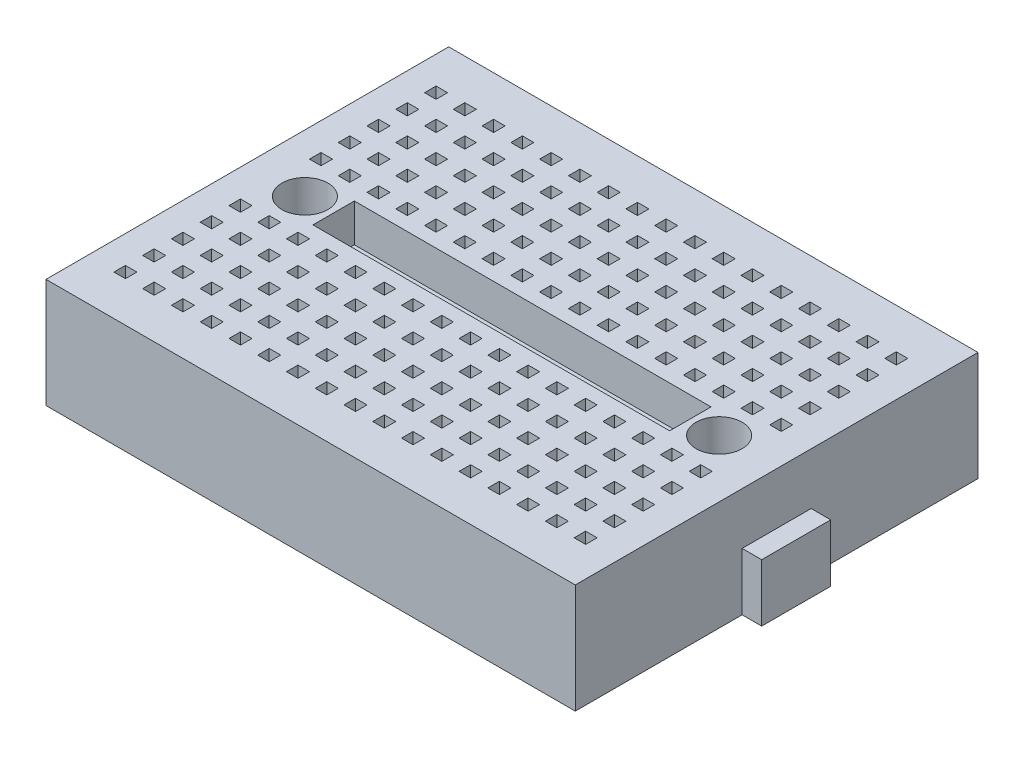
SolidWorks part; units mm, degrees
ref_plane "Alzado" through (0, 0, 0) normal (0, 0, 1) x (1, 0, 0)
ref_plane "Planta" through (0, 0, 0) normal (0, 1, 0) x (1, 0, 0)
ref_plane "Vista lateral" through (0, 0, 0) normal (1, 0, 0) x (0, 0, -1)
sketch "Croquis1" plane through (0, 0, 0) normal (0, 1, 0) x (1, 0, 0)
  line L1 (0, 0) -> (46, 0)
  line L2 (0, 0) -> (0, 35)
  line L3 (0, 35) -> (46, 35)
  line L4 (46, 0) -> (46, 35)
  dimension "D1" = 35
  dimension "D2" = 46
extrude "Saliente-Extruir1" add sketch "Croquis1" along normal blind 9.5
sketch "Croquis2" plane through (46, 0, 0) normal (1, 0, 0) x (0, 0, -1)
  line L0 (0, 0) -> (35, 0) construction
  line L1 (20.5, 0) -> (14.5, 0)
  line L2 (20.5, 0) -> (20.5, 5)
  line L3 (20.5, 5) -> (14.5, 5)
  line L4 (14.5, 0) -> (14.5, 5)
  line L5 (0, 9.5) -> (0, 0) construction
  line L6 (35, 9.5) -> (35, 0) construction
  dimension "D1" = 14.5
  dimension "D2" = 14.5
  dimension "D3" = 5
extrude "Saliente-Extruir2" add sketch "Croquis2" along normal blind 1.7
sketch "Croquis3" plane through (0, 9.5, 0) normal (0, 1, 0) x (1, 0, 0)
  line L0 (46, 0) -> (46, 35) construction
  line L1 (7.5, 19.3) -> (38.5, 19.3)
  line L2 (7.5, 19.3) -> (7.5, 15.7)
  line L3 (7.5, 15.7) -> (38.5, 15.7)
  line L4 (38.5, 19.3) -> (38.5, 15.7)
  line L5 (0, 35) -> (0, 0) construction
  point P8 (7.5, 17.5)
  point P9 (0, 17.5)
  dimension "D1" = 3.6
  dimension "D2" = 7.5
  dimension "D3" = 7.5
extrude "Cortar-Extruir1" cut sketch "Croquis3" against normal blind 3.3
sketch "Croquis4" plane through (0, 9.5, 0) normal (0, 1, 0) x (1, 0, 0)
  line L0 (7.5, 19.3) -> (7.5, 15.7) construction
  line L1 (0, 35) -> (0, 0) construction
  line L2 (46, 0) -> (46, 35) construction
  circle A0 centre (41, 17.5) radius 2
  circle A1 centre (5, 17.5) radius 2
  point P6 (7.5, 17.5)
  dimension "D1" = 4
  dimension "D2" = 5
  dimension "D3" = 5
extrude "Cortar-Extruir2" cut sketch "Croquis4" against normal blind 3.5
sketch "Croquis5" plane through (0, 0, -35) normal (0, 0, -1) x (-1, 0, 0)
  line L0 (-46, 0) -> (0, 0) construction
  line L1 (-25.25, 0) -> (-20.75, 0)
  line L2 (-25.25, 0) -> (-25.25, 5)
  line L3 (-25.25, 5) -> (-20.75, 5)
  line L4 (-20.75, 0) -> (-20.75, 5)
  line L5 (-46, 9.5) -> (0, 9.5) construction
  point P6 (-23, 5)
  point P9 (-23, 9.5)
  dimension "D1" = 4.5
  dimension "D2" = 5
extrude "Saliente-Extruir3" add sketch "Croquis5" along normal blind 1.5
sketch "Croquis6" plane through (0, 9.5, 0) normal (0, 1, 0) x (1, 0, 0)
  line L0 (0, 35) -> (0, 0) construction
  line L1 (2.4, 14.5) -> (3.4, 14.5)
  line L2 (2.4, 14.5) -> (2.4, 13.5)
  line L3 (2.4, 13.5) -> (3.4, 13.5)
  line L4 (3.4, 14.5) -> (3.4, 13.5)
  line L6 (7.5, 15.7) -> (38.5, 15.7) construction
  line L7 (5.9, 14.5) -> (5.9, 13.5)
  line L8 (4.9, 14.5) -> (5.9, 14.5)
  line L9 (4.9, 14.5) -> (4.9, 13.5)
  line L10 (4.9, 13.5) -> (5.9, 13.5)
  line L11 (8.4, 14.5) -> (8.4, 13.5)
  line L12 (7.4, 14.5) -> (8.4, 14.5)
  line L13 (7.4, 14.5) -> (7.4, 13.5)
  line L14 (7.4, 13.5) -> (8.4, 13.5)
  line L15 (10.9, 14.5) -> (10.9, 13.5)
  line L16 (9.9, 14.5) -> (10.9, 14.5)
  line L17 (9.9, 14.5) -> (9.9, 13.5)
  line L18 (9.9, 13.5) -> (10.9, 13.5)
  line L19 (13.4, 14.5) -> (13.4, 13.5)
  line L20 (12.4, 14.5) -> (13.4, 14.5)
  line L21 (12.4, 14.5) -> (12.4, 13.5)
  line L22 (12.4, 13.5) -> (13.4, 13.5)
  line L23 (15.9, 14.5) -> (15.9, 13.5)
  line L24 (14.9, 14.5) -> (15.9, 14.5)
  line L25 (14.9, 14.5) -> (14.9, 13.5)
  line L26 (14.9, 13.5) -> (15.9, 13.5)
  line L27 (18.4, 14.5) -> (18.4, 13.5)
  line L28 (17.4, 14.5) -> (18.4, 14.5)
  line L29 (17.4, 14.5) -> (17.4, 13.5)
  line L30 (17.4, 13.5) -> (18.4, 13.5)
  line L31 (20.9, 14.5) -> (20.9, 13.5)
  line L32 (19.9, 14.5) -> (20.9, 14.5)
  line L33 (19.9, 14.5) -> (19.9, 13.5)
  line L34 (19.9, 13.5) -> (20.9, 13.5)
  line L35 (23.4, 14.5) -> (23.4, 13.5)
  line L36 (22.4, 14.5) -> (23.4, 14.5)
  line L37 (22.4, 14.5) -> (22.4, 13.5)
  line L38 (22.4, 13.5) -> (23.4, 13.5)
  line L39 (25.9, 14.5) -> (25.9, 13.5)
  line L40 (24.9, 14.5) -> (25.9, 14.5)
  line L41 (24.9, 14.5) -> (24.9, 13.5)
  line L42 (24.9, 13.5) -> (25.9, 13.5)
  line L43 (28.4, 14.5) -> (28.4, 13.5)
  line L44 (27.4, 14.5) -> (28.4, 14.5)
  line L45 (27.4, 14.5) -> (27.4, 13.5)
  line L46 (27.4, 13.5) -> (28.4, 13.5)
  line L47 (30.9, 14.5) -> (30.9, 13.5)
  line L48 (29.9, 14.5) -> (30.9, 14.5)
  line L49 (29.9, 14.5) -> (29.9, 13.5)
  line L50 (29.9, 13.5) -> (30.9, 13.5)
  line L51 (33.4, 14.5) -> (33.4, 13.5)
  line L52 (32.4, 14.5) -> (33.4, 14.5)
  line L53 (32.4, 14.5) -> (32.4, 13.5)
  line L54 (32.4, 13.5) -> (33.4, 13.5)
  line L55 (35.9, 14.5) -> (35.9, 13.5)
  line L56 (34.9, 14.5) -> (35.9, 14.5)
  line L57 (34.9, 14.5) -> (34.9, 13.5)
  line L58 (34.9, 13.5) -> (35.9, 13.5)
  line L59 (38.4, 14.5) -> (38.4, 13.5)
  line L60 (37.4, 14.5) -> (38.4, 14.5)
  line L61 (37.4, 14.5) -> (37.4, 13.5)
  line L62 (37.4, 13.5) -> (38.4, 13.5)
  line L63 (40.9, 14.5) -> (40.9, 13.5)
  line L64 (39.9, 14.5) -> (40.9, 14.5)
  line L65 (39.9, 14.5) -> (39.9, 13.5)
  line L66 (39.9, 13.5) -> (40.9, 13.5)
  line L67 (43.4, 14.5) -> (43.4, 13.5)
  line L68 (42.4, 14.5) -> (43.4, 14.5)
  line L69 (42.4, 14.5) -> (42.4, 13.5)
  line L70 (42.4, 13.5) -> (43.4, 13.5)
  line L71 (5.9, 12) -> (5.9, 11)
  line L72 (4.9, 12) -> (5.9, 12)
  line L73 (4.9, 12) -> (4.9, 11)
  line L74 (4.9, 11) -> (5.9, 11)
  line L75 (8.4, 12) -> (8.4, 11)
  line L76 (7.4, 12) -> (8.4, 12)
  line L77 (7.4, 12) -> (7.4, 11)
  line L78 (7.4, 11) -> (8.4, 11)
  line L79 (10.9, 12) -> (10.9, 11)
  line L80 (9.9, 12) -> (10.9, 12)
  line L81 (9.9, 12) -> (9.9, 11)
  line L82 (9.9, 11) -> (10.9, 11)
  line L83 (13.4, 12) -> (13.4, 11)
  line L84 (12.4, 12) -> (13.4, 12)
  line L85 (12.4, 12) -> (12.4, 11)
  line L86 (12.4, 11) -> (13.4, 11)
  line L87 (15.9, 12) -> (15.9, 11)
  line L88 (14.9, 12) -> (15.9, 12)
  line L89 (14.9, 12) -> (14.9, 11)
  line L90 (14.9, 11) -> (15.9, 11)
  line L91 (18.4, 12) -> (18.4, 11)
  line L92 (17.4, 12) -> (18.4, 12)
  line L93 (17.4, 12) -> (17.4, 11)
  line L94 (17.4, 11) -> (18.4, 11)
  line L95 (20.9, 12) -> (20.9, 11)
  line L96 (19.9, 12) -> (20.9, 12)
  line L97 (19.9, 12) -> (19.9, 11)
  line L98 (19.9, 11) -> (20.9, 11)
  line L99 (23.4, 12) -> (23.4, 11)
  line L100 (22.4, 12) -> (23.4, 12)
  line L101 (22.4, 12) -> (22.4, 11)
  line L102 (22.4, 11) -> (23.4, 11)
  line L103 (25.9, 12) -> (25.9, 11)
  line L104 (24.9, 12) -> (25.9, 12)
  line L105 (24.9, 12) -> (24.9, 11)
  line L106 (24.9, 11) -> (25.9, 11)
  line L107 (28.4, 12) -> (28.4, 11)
  line L108 (27.4, 12) -> (28.4, 12)
  line L109 (27.4, 12) -> (27.4, 11)
  line L110 (27.4, 11) -> (28.4, 11)
  line L111 (30.9, 12) -> (30.9, 11)
  line L112 (29.9, 12) -> (30.9, 12)
  line L113 (29.9, 12) -> (29.9, 11)
  line L114 (29.9, 11) -> (30.9, 11)
  line L115 (33.4, 12) -> (33.4, 11)
  line L116 (32.4, 12) -> (33.4, 12)
  line L117 (32.4, 12) -> (32.4, 11)
  line L118 (32.4, 11) -> (33.4, 11)
  line L119 (35.9, 12) -> (35.9, 11)
  line L120 (34.9, 12) -> (35.9, 12)
  line L121 (34.9, 12) -> (34.9, 11)
  line L122 (34.9, 11) -> (35.9, 11)
  line L123 (38.4, 12) -> (38.4, 11)
  line L124 (37.4, 12) -> (38.4, 12)
  line L125 (37.4, 12) -> (37.4, 11)
  line L126 (37.4, 11) -> (38.4, 11)
  line L127 (40.9, 12) -> (40.9, 11)
  line L128 (39.9, 12) -> (40.9, 12)
  line L129 (39.9, 12) -> (39.9, 11)
  line L130 (39.9, 11) -> (40.9, 11)
  line L131 (43.4, 12) -> (43.4, 11)
  line L132 (42.4, 12) -> (43.4, 12)
  line L133 (42.4, 12) -> (42.4, 11)
  line L134 (42.4, 11) -> (43.4, 11)
  line L135 (5.9, 9.5) -> (5.9, 8.5)
  line L136 (4.9, 9.5) -> (5.9, 9.5)
  line L137 (4.9, 9.5) -> (4.9, 8.5)
  line L138 (4.9, 8.5) -> (5.9, 8.5)
  line L139 (8.4, 9.5) -> (8.4, 8.5)
  line L140 (7.4, 9.5) -> (8.4, 9.5)
  line L141 (7.4, 9.5) -> (7.4, 8.5)
  line L142 (7.4, 8.5) -> (8.4, 8.5)
  line L143 (10.9, 9.5) -> (10.9, 8.5)
  line L144 (9.9, 9.5) -> (10.9, 9.5)
  line L145 (9.9, 9.5) -> (9.9, 8.5)
  line L146 (9.9, 8.5) -> (10.9, 8.5)
  line L147 (13.4, 9.5) -> (13.4, 8.5)
  line L148 (12.4, 9.5) -> (13.4, 9.5)
  line L149 (12.4, 9.5) -> (12.4, 8.5)
  line L150 (12.4, 8.5) -> (13.4, 8.5)
  line L151 (15.9, 9.5) -> (15.9, 8.5)
  line L152 (14.9, 9.5) -> (15.9, 9.5)
  line L153 (14.9, 9.5) -> (14.9, 8.5)
  line L154 (14.9, 8.5) -> (15.9, 8.5)
  line L155 (18.4, 9.5) -> (18.4, 8.5)
  line L156 (17.4, 9.5) -> (18.4, 9.5)
  line L157 (17.4, 9.5) -> (17.4, 8.5)
  line L158 (17.4, 8.5) -> (18.4, 8.5)
  line L159 (20.9, 9.5) -> (20.9, 8.5)
  line L160 (19.9, 9.5) -> (20.9, 9.5)
  line L161 (19.9, 9.5) -> (19.9, 8.5)
  line L162 (19.9, 8.5) -> (20.9, 8.5)
  line L163 (23.4, 9.5) -> (23.4, 8.5)
  line L164 (22.4, 9.5) -> (23.4, 9.5)
  line L165 (22.4, 9.5) -> (22.4, 8.5)
  line L166 (22.4, 8.5) -> (23.4, 8.5)
  line L167 (25.9, 9.5) -> (25.9, 8.5)
  line L168 (24.9, 9.5) -> (25.9, 9.5)
  line L169 (24.9, 9.5) -> (24.9, 8.5)
  line L170 (24.9, 8.5) -> (25.9, 8.5)
  line L171 (28.4, 9.5) -> (28.4, 8.5)
  line L172 (27.4, 9.5) -> (28.4, 9.5)
  line L173 (27.4, 9.5) -> (27.4, 8.5)
  line L174 (27.4, 8.5) -> (28.4, 8.5)
  line L175 (30.9, 9.5) -> (30.9, 8.5)
  line L176 (29.9, 9.5) -> (30.9, 9.5)
  line L177 (29.9, 9.5) -> (29.9, 8.5)
  line L178 (29.9, 8.5) -> (30.9, 8.5)
  line L179 (33.4, 9.5) -> (33.4, 8.5)
  line L180 (32.4, 9.5) -> (33.4, 9.5)
  line L181 (32.4, 9.5) -> (32.4, 8.5)
  line L182 (32.4, 8.5) -> (33.4, 8.5)
  line L183 (35.9, 9.5) -> (35.9, 8.5)
  line L184 (34.9, 9.5) -> (35.9, 9.5)
  line L185 (34.9, 9.5) -> (34.9, 8.5)
  line L186 (34.9, 8.5) -> (35.9, 8.5)
  line L187 (38.4, 9.5) -> (38.4, 8.5)
  line L188 (37.4, 9.5) -> (38.4, 9.5)
  line L189 (37.4, 9.5) -> (37.4, 8.5)
  line L190 (37.4, 8.5) -> (38.4, 8.5)
  line L191 (40.9, 9.5) -> (40.9, 8.5)
  line L192 (39.9, 9.5) -> (40.9, 9.5)
  line L193 (39.9, 9.5) -> (39.9, 8.5)
  line L194 (39.9, 8.5) -> (40.9, 8.5)
  line L195 (43.4, 9.5) -> (43.4, 8.5)
  line L196 (42.4, 9.5) -> (43.4, 9.5)
  line L197 (42.4, 9.5) -> (42.4, 8.5)
  line L198 (42.4, 8.5) -> (43.4, 8.5)
  line L199 (5.9, 7) -> (5.9, 6)
  line L200 (4.9, 7) -> (5.9, 7)
  line L201 (4.9, 7) -> (4.9, 6)
  line L202 (4.9, 6) -> (5.9, 6)
  line L203 (8.4, 7) -> (8.4, 6)
  line L204 (7.4, 7) -> (8.4, 7)
  line L205 (7.4, 7) -> (7.4, 6)
  line L206 (7.4, 6) -> (8.4, 6)
  line L207 (10.9, 7) -> (10.9, 6)
  line L208 (9.9, 7) -> (10.9, 7)
  line L209 (9.9, 7) -> (9.9, 6)
  line L210 (9.9, 6) -> (10.9, 6)
  line L211 (13.4, 7) -> (13.4, 6)
  line L212 (12.4, 7) -> (13.4, 7)
  line L213 (12.4, 7) -> (12.4, 6)
  line L214 (12.4, 6) -> (13.4, 6)
  line L215 (15.9, 7) -> (15.9, 6)
  line L216 (14.9, 7) -> (15.9, 7)
  line L217 (14.9, 7) -> (14.9, 6)
  line L218 (14.9, 6) -> (15.9, 6)
  line L219 (18.4, 7) -> (18.4, 6)
  line L220 (17.4, 7) -> (18.4, 7)
  line L221 (17.4, 7) -> (17.4, 6)
  line L222 (17.4, 6) -> (18.4, 6)
  line L223 (20.9, 7) -> (20.9, 6)
  line L224 (19.9, 7) -> (20.9, 7)
  line L225 (19.9, 7) -> (19.9, 6)
  line L226 (19.9, 6) -> (20.9, 6)
  line L227 (23.4, 7) -> (23.4, 6)
  line L228 (22.4, 7) -> (23.4, 7)
  line L229 (22.4, 7) -> (22.4, 6)
  line L230 (22.4, 6) -> (23.4, 6)
  line L231 (25.9, 7) -> (25.9, 6)
  line L232 (24.9, 7) -> (25.9, 7)
  line L233 (24.9, 7) -> (24.9, 6)
  line L234 (24.9, 6) -> (25.9, 6)
  line L235 (28.4, 7) -> (28.4, 6)
  line L236 (27.4, 7) -> (28.4, 7)
  line L237 (27.4, 7) -> (27.4, 6)
  line L238 (27.4, 6) -> (28.4, 6)
  line L239 (30.9, 7) -> (30.9, 6)
  line L240 (29.9, 7) -> (30.9, 7)
  line L241 (29.9, 7) -> (29.9, 6)
  line L242 (29.9, 6) -> (30.9, 6)
  line L243 (33.4, 7) -> (33.4, 6)
  line L244 (32.4, 7) -> (33.4, 7)
  line L245 (32.4, 7) -> (32.4, 6)
  line L246 (32.4, 6) -> (33.4, 6)
  line L247 (35.9, 7) -> (35.9, 6)
  line L248 (34.9, 7) -> (35.9, 7)
  line L249 (34.9, 7) -> (34.9, 6)
  line L250 (34.9, 6) -> (35.9, 6)
  line L251 (38.4, 7) -> (38.4, 6)
  line L252 (37.4, 7) -> (38.4, 7)
  line L253 (37.4, 7) -> (37.4, 6)
  line L254 (37.4, 6) -> (38.4, 6)
  line L255 (40.9, 7) -> (40.9, 6)
  line L256 (39.9, 7) -> (40.9, 7)
  line L257 (39.9, 7) -> (39.9, 6)
  line L258 (39.9, 6) -> (40.9, 6)
  line L259 (43.4, 7) -> (43.4, 6)
  line L260 (42.4, 7) -> (43.4, 7)
  line L261 (42.4, 7) -> (42.4, 6)
  line L262 (42.4, 6) -> (43.4, 6)
  line L263 (5.9, 4.5) -> (5.9, 3.5)
  line L264 (4.9, 4.5) -> (5.9, 4.5)
  line L265 (4.9, 4.5) -> (4.9, 3.5)
  line L266 (4.9, 3.5) -> (5.9, 3.5)
  line L267 (8.4, 4.5) -> (8.4, 3.5)
  line L268 (7.4, 4.5) -> (8.4, 4.5)
  line L269 (7.4, 4.5) -> (7.4, 3.5)
  line L270 (7.4, 3.5) -> (8.4, 3.5)
  line L271 (10.9, 4.5) -> (10.9, 3.5)
  line L272 (9.9, 4.5) -> (10.9, 4.5)
  line L273 (9.9, 4.5) -> (9.9, 3.5)
  line L274 (9.9, 3.5) -> (10.9, 3.5)
  line L275 (13.4, 4.5) -> (13.4, 3.5)
  line L276 (12.4, 4.5) -> (13.4, 4.5)
  line L277 (12.4, 4.5) -> (12.4, 3.5)
  line L278 (12.4, 3.5) -> (13.4, 3.5)
  line L279 (15.9, 4.5) -> (15.9, 3.5)
  line L280 (14.9, 4.5) -> (15.9, 4.5)
  line L281 (14.9, 4.5) -> (14.9, 3.5)
  line L282 (14.9, 3.5) -> (15.9, 3.5)
  line L283 (18.4, 4.5) -> (18.4, 3.5)
  line L284 (17.4, 4.5) -> (18.4, 4.5)
  line L285 (17.4, 4.5) -> (17.4, 3.5)
  line L286 (17.4, 3.5) -> (18.4, 3.5)
  line L287 (20.9, 4.5) -> (20.9, 3.5)
  line L288 (19.9, 4.5) -> (20.9, 4.5)
  line L289 (19.9, 4.5) -> (19.9, 3.5)
  line L290 (19.9, 3.5) -> (20.9, 3.5)
  line L291 (23.4, 4.5) -> (23.4, 3.5)
  line L292 (22.4, 4.5) -> (23.4, 4.5)
  line L293 (22.4, 4.5) -> (22.4, 3.5)
  line L294 (22.4, 3.5) -> (23.4, 3.5)
  line L295 (25.9, 4.5) -> (25.9, 3.5)
  line L296 (24.9, 4.5) -> (25.9, 4.5)
  line L297 (24.9, 4.5) -> (24.9, 3.5)
  line L298 (24.9, 3.5) -> (25.9, 3.5)
  line L299 (28.4, 4.5) -> (28.4, 3.5)
  line L300 (27.4, 4.5) -> (28.4, 4.5)
  line L301 (27.4, 4.5) -> (27.4, 3.5)
  line L302 (27.4, 3.5) -> (28.4, 3.5)
  line L303 (30.9, 4.5) -> (30.9, 3.5)
  line L304 (29.9, 4.5) -> (30.9, 4.5)
  line L305 (29.9, 4.5) -> (29.9, 3.5)
  line L306 (29.9, 3.5) -> (30.9, 3.5)
  line L307 (33.4, 4.5) -> (33.4, 3.5)
  line L308 (32.4, 4.5) -> (33.4, 4.5)
  line L309 (32.4, 4.5) -> (32.4, 3.5)
  line L310 (32.4, 3.5) -> (33.4, 3.5)
  line L311 (35.9, 4.5) -> (35.9, 3.5)
  line L312 (34.9, 4.5) -> (35.9, 4.5)
  line L313 (34.9, 4.5) -> (34.9, 3.5)
  line L314 (34.9, 3.5) -> (35.9, 3.5)
  line L315 (38.4, 4.5) -> (38.4, 3.5)
  line L316 (37.4, 4.5) -> (38.4, 4.5)
  line L317 (37.4, 4.5) -> (37.4, 3.5)
  line L318 (37.4, 3.5) -> (38.4, 3.5)
  line L319 (40.9, 4.5) -> (40.9, 3.5)
  line L320 (39.9, 4.5) -> (40.9, 4.5)
  line L321 (39.9, 4.5) -> (39.9, 3.5)
  line L322 (39.9, 3.5) -> (40.9, 3.5)
  line L323 (43.4, 4.5) -> (43.4, 3.5)
  line L324 (42.4, 4.5) -> (43.4, 4.5)
  line L325 (42.4, 4.5) -> (42.4, 3.5)
  line L326 (42.4, 3.5) -> (43.4, 3.5)
  line L327 (3.4, 12) -> (3.4, 11)
  line L328 (2.4, 12) -> (3.4, 12)
  line L329 (2.4, 12) -> (2.4, 11)
  line L330 (2.4, 11) -> (3.4, 11)
  line L331 (3.4, 9.5) -> (3.4, 8.5)
  line L332 (2.4, 9.5) -> (3.4, 9.5)
  line L333 (2.4, 9.5) -> (2.4, 8.5)
  line L334 (2.4, 8.5) -> (3.4, 8.5)
  line L335 (3.4, 7) -> (3.4, 6)
  line L336 (2.4, 7) -> (3.4, 7)
  line L337 (2.4, 7) -> (2.4, 6)
  line L338 (2.4, 6) -> (3.4, 6)
  line L339 (3.4, 4.5) -> (3.4, 3.5)
  line L340 (2.4, 4.5) -> (3.4, 4.5)
  line L341 (2.4, 4.5) -> (2.4, 3.5)
  line L342 (2.4, 3.5) -> (3.4, 3.5)
  line L343 (0, 0) -> (46, 0) construction
  line L344 (46, 0) -> (46, 35) construction
  line L345 (7.5, 17.5) -> (38.5, 17.5) construction
  line L346 (7.5, 19.3) -> (7.5, 15.7) construction
  line L347 (38.5, 15.7) -> (38.5, 19.3) construction
  line L348 (2.4, 31.5) -> (3.4, 31.5)
  line L349 (2.4, 30.5) -> (2.4, 31.5)
  line L350 (2.4, 30.5) -> (3.4, 30.5)
  line L351 (3.4, 30.5) -> (3.4, 31.5)
  line L352 (2.4, 29) -> (3.4, 29)
  line L353 (2.4, 28) -> (2.4, 29)
  line L354 (2.4, 28) -> (3.4, 28)
  line L355 (3.4, 28) -> (3.4, 29)
  line L356 (2.4, 26.5) -> (3.4, 26.5)
  line L357 (2.4, 25.5) -> (2.4, 26.5)
  line L358 (2.4, 25.5) -> (3.4, 25.5)
  line L359 (3.4, 25.5) -> (3.4, 26.5)
  line L360 (2.4, 24) -> (3.4, 24)
  line L361 (2.4, 23) -> (2.4, 24)
  line L362 (2.4, 23) -> (3.4, 23)
  line L363 (3.4, 23) -> (3.4, 24)
  line L364 (42.4, 31.5) -> (43.4, 31.5)
  line L365 (42.4, 30.5) -> (42.4, 31.5)
  line L366 (42.4, 30.5) -> (43.4, 30.5)
  line L367 (43.4, 30.5) -> (43.4, 31.5)
  line L368 (39.9, 31.5) -> (40.9, 31.5)
  line L369 (39.9, 30.5) -> (39.9, 31.5)
  line L370 (39.9, 30.5) -> (40.9, 30.5)
  line L371 (40.9, 30.5) -> (40.9, 31.5)
  line L372 (37.4, 31.5) -> (38.4, 31.5)
  line L373 (37.4, 30.5) -> (37.4, 31.5)
  line L374 (37.4, 30.5) -> (38.4, 30.5)
  line L375 (38.4, 30.5) -> (38.4, 31.5)
  line L376 (34.9, 31.5) -> (35.9, 31.5)
  line L377 (34.9, 30.5) -> (34.9, 31.5)
  line L378 (34.9, 30.5) -> (35.9, 30.5)
  line L379 (35.9, 30.5) -> (35.9, 31.5)
  line L380 (32.4, 31.5) -> (33.4, 31.5)
  line L381 (32.4, 30.5) -> (32.4, 31.5)
  line L382 (32.4, 30.5) -> (33.4, 30.5)
  line L383 (33.4, 30.5) -> (33.4, 31.5)
  line L384 (29.9, 31.5) -> (30.9, 31.5)
  line L385 (29.9, 30.5) -> (29.9, 31.5)
  line L386 (29.9, 30.5) -> (30.9, 30.5)
  line L387 (30.9, 30.5) -> (30.9, 31.5)
  line L388 (27.4, 31.5) -> (28.4, 31.5)
  line L389 (27.4, 30.5) -> (27.4, 31.5)
  line L390 (27.4, 30.5) -> (28.4, 30.5)
  line L391 (28.4, 30.5) -> (28.4, 31.5)
  line L392 (24.9, 31.5) -> (25.9, 31.5)
  line L393 (24.9, 30.5) -> (24.9, 31.5)
  line L394 (24.9, 30.5) -> (25.9, 30.5)
  line L395 (25.9, 30.5) -> (25.9, 31.5)
  line L396 (22.4, 31.5) -> (23.4, 31.5)
  line L397 (22.4, 30.5) -> (22.4, 31.5)
  line L398 (22.4, 30.5) -> (23.4, 30.5)
  line L399 (23.4, 30.5) -> (23.4, 31.5)
  line L400 (19.9, 31.5) -> (20.9, 31.5)
  line L401 (19.9, 30.5) -> (19.9, 31.5)
  line L402 (19.9, 30.5) -> (20.9, 30.5)
  line L403 (20.9, 30.5) -> (20.9, 31.5)
  line L404 (17.4, 31.5) -> (18.4, 31.5)
  line L405 (17.4, 30.5) -> (17.4, 31.5)
  line L406 (17.4, 30.5) -> (18.4, 30.5)
  line L407 (18.4, 30.5) -> (18.4, 31.5)
  line L408 (14.9, 31.5) -> (15.9, 31.5)
  line L409 (14.9, 30.5) -> (14.9, 31.5)
  line L410 (14.9, 30.5) -> (15.9, 30.5)
  line L411 (15.9, 30.5) -> (15.9, 31.5)
  line L412 (12.4, 31.5) -> (13.4, 31.5)
  line L413 (12.4, 30.5) -> (12.4, 31.5)
  line L414 (12.4, 30.5) -> (13.4, 30.5)
  line L415 (13.4, 30.5) -> (13.4, 31.5)
  line L416 (9.9, 31.5) -> (10.9, 31.5)
  line L417 (9.9, 30.5) -> (9.9, 31.5)
  line L418 (9.9, 30.5) -> (10.9, 30.5)
  line L419 (10.9, 30.5) -> (10.9, 31.5)
  line L420 (7.4, 31.5) -> (8.4, 31.5)
  line L421 (7.4, 30.5) -> (7.4, 31.5)
  line L422 (7.4, 30.5) -> (8.4, 30.5)
  line L423 (8.4, 30.5) -> (8.4, 31.5)
  line L424 (4.9, 31.5) -> (5.9, 31.5)
  line L425 (4.9, 30.5) -> (4.9, 31.5)
  line L426 (4.9, 30.5) -> (5.9, 30.5)
  line L427 (5.9, 30.5) -> (5.9, 31.5)
  line L428 (42.4, 29) -> (43.4, 29)
  line L429 (42.4, 28) -> (42.4, 29)
  line L430 (42.4, 28) -> (43.4, 28)
  line L431 (43.4, 28) -> (43.4, 29)
  line L432 (39.9, 29) -> (40.9, 29)
  line L433 (39.9, 28) -> (39.9, 29)
  line L434 (39.9, 28) -> (40.9, 28)
  line L435 (40.9, 28) -> (40.9, 29)
  line L436 (37.4, 29) -> (38.4, 29)
  line L437 (37.4, 28) -> (37.4, 29)
  line L438 (37.4, 28) -> (38.4, 28)
  line L439 (38.4, 28) -> (38.4, 29)
  line L440 (34.9, 29) -> (35.9, 29)
  line L441 (34.9, 28) -> (34.9, 29)
  line L442 (34.9, 28) -> (35.9, 28)
  line L443 (35.9, 28) -> (35.9, 29)
  line L444 (32.4, 29) -> (33.4, 29)
  line L445 (32.4, 28) -> (32.4, 29)
  line L446 (32.4, 28) -> (33.4, 28)
  line L447 (33.4, 28) -> (33.4, 29)
  line L448 (29.9, 29) -> (30.9, 29)
  line L449 (29.9, 28) -> (29.9, 29)
  line L450 (29.9, 28) -> (30.9, 28)
  line L451 (30.9, 28) -> (30.9, 29)
  line L452 (27.4, 29) -> (28.4, 29)
  line L453 (27.4, 28) -> (27.4, 29)
  line L454 (27.4, 28) -> (28.4, 28)
  line L455 (28.4, 28) -> (28.4, 29)
  line L456 (24.9, 29) -> (25.9, 29)
  line L457 (24.9, 28) -> (24.9, 29)
  line L458 (24.9, 28) -> (25.9, 28)
  line L459 (25.9, 28) -> (25.9, 29)
  line L460 (22.4, 29) -> (23.4, 29)
  line L461 (22.4, 28) -> (22.4, 29)
  line L462 (22.4, 28) -> (23.4, 28)
  line L463 (23.4, 28) -> (23.4, 29)
  line L464 (19.9, 29) -> (20.9, 29)
  line L465 (19.9, 28) -> (19.9, 29)
  line L466 (19.9, 28) -> (20.9, 28)
  line L467 (20.9, 28) -> (20.9, 29)
  line L468 (17.4, 29) -> (18.4, 29)
  line L469 (17.4, 28) -> (17.4, 29)
  line L470 (17.4, 28) -> (18.4, 28)
  line L471 (18.4, 28) -> (18.4, 29)
  line L472 (14.9, 29) -> (15.9, 29)
  line L473 (14.9, 28) -> (14.9, 29)
  line L474 (14.9, 28) -> (15.9, 28)
  line L475 (15.9, 28) -> (15.9, 29)
  line L476 (12.4, 29) -> (13.4, 29)
  line L477 (12.4, 28) -> (12.4, 29)
  line L478 (12.4, 28) -> (13.4, 28)
  line L479 (13.4, 28) -> (13.4, 29)
  line L480 (9.9, 29) -> (10.9, 29)
  line L481 (9.9, 28) -> (9.9, 29)
  line L482 (9.9, 28) -> (10.9, 28)
  line L483 (10.9, 28) -> (10.9, 29)
  line L484 (7.4, 29) -> (8.4, 29)
  line L485 (7.4, 28) -> (7.4, 29)
  line L486 (7.4, 28) -> (8.4, 28)
  line L487 (8.4, 28) -> (8.4, 29)
  line L488 (4.9, 29) -> (5.9, 29)
  line L489 (4.9, 28) -> (4.9, 29)
  line L490 (4.9, 28) -> (5.9, 28)
  line L491 (5.9, 28) -> (5.9, 29)
  line L492 (42.4, 26.5) -> (43.4, 26.5)
  line L493 (42.4, 25.5) -> (42.4, 26.5)
  line L494 (42.4, 25.5) -> (43.4, 25.5)
  line L495 (43.4, 25.5) -> (43.4, 26.5)
  line L496 (39.9, 26.5) -> (40.9, 26.5)
  line L497 (39.9, 25.5) -> (39.9, 26.5)
  line L498 (39.9, 25.5) -> (40.9, 25.5)
  line L499 (40.9, 25.5) -> (40.9, 26.5)
  line L500 (37.4, 26.5) -> (38.4, 26.5)
  line L501 (37.4, 25.5) -> (37.4, 26.5)
  line L502 (37.4, 25.5) -> (38.4, 25.5)
  line L503 (38.4, 25.5) -> (38.4, 26.5)
  line L504 (34.9, 26.5) -> (35.9, 26.5)
  line L505 (34.9, 25.5) -> (34.9, 26.5)
  line L506 (34.9, 25.5) -> (35.9, 25.5)
  line L507 (35.9, 25.5) -> (35.9, 26.5)
  line L508 (32.4, 26.5) -> (33.4, 26.5)
  line L509 (32.4, 25.5) -> (32.4, 26.5)
  line L510 (32.4, 25.5) -> (33.4, 25.5)
  line L511 (33.4, 25.5) -> (33.4, 26.5)
  line L512 (29.9, 26.5) -> (30.9, 26.5)
  line L513 (29.9, 25.5) -> (29.9, 26.5)
  line L514 (29.9, 25.5) -> (30.9, 25.5)
  line L515 (30.9, 25.5) -> (30.9, 26.5)
  line L516 (27.4, 26.5) -> (28.4, 26.5)
  line L517 (27.4, 25.5) -> (27.4, 26.5)
  line L518 (27.4, 25.5) -> (28.4, 25.5)
  line L519 (28.4, 25.5) -> (28.4, 26.5)
  line L520 (24.9, 26.5) -> (25.9, 26.5)
  line L521 (24.9, 25.5) -> (24.9, 26.5)
  line L522 (24.9, 25.5) -> (25.9, 25.5)
  line L523 (25.9, 25.5) -> (25.9, 26.5)
  line L524 (22.4, 26.5) -> (23.4, 26.5)
  line L525 (22.4, 25.5) -> (22.4, 26.5)
  line L526 (22.4, 25.5) -> (23.4, 25.5)
  line L527 (23.4, 25.5) -> (23.4, 26.5)
  line L528 (19.9, 26.5) -> (20.9, 26.5)
  line L529 (19.9, 25.5) -> (19.9, 26.5)
  line L530 (19.9, 25.5) -> (20.9, 25.5)
  line L531 (20.9, 25.5) -> (20.9, 26.5)
  line L532 (17.4, 26.5) -> (18.4, 26.5)
  line L533 (17.4, 25.5) -> (17.4, 26.5)
  line L534 (17.4, 25.5) -> (18.4, 25.5)
  line L535 (18.4, 25.5) -> (18.4, 26.5)
  line L536 (14.9, 26.5) -> (15.9, 26.5)
  line L537 (14.9, 25.5) -> (14.9, 26.5)
  line L538 (14.9, 25.5) -> (15.9, 25.5)
  line L539 (15.9, 25.5) -> (15.9, 26.5)
  line L540 (12.4, 26.5) -> (13.4, 26.5)
  line L541 (12.4, 25.5) -> (12.4, 26.5)
  line L542 (12.4, 25.5) -> (13.4, 25.5)
  line L543 (13.4, 25.5) -> (13.4, 26.5)
  line L544 (9.9, 26.5) -> (10.9, 26.5)
  line L545 (9.9, 25.5) -> (9.9, 26.5)
  line L546 (9.9, 25.5) -> (10.9, 25.5)
  line L547 (10.9, 25.5) -> (10.9, 26.5)
  line L548 (7.4, 26.5) -> (8.4, 26.5)
  line L549 (7.4, 25.5) -> (7.4, 26.5)
  line L550 (7.4, 25.5) -> (8.4, 25.5)
  line L551 (8.4, 25.5) -> (8.4, 26.5)
  line L552 (4.9, 26.5) -> (5.9, 26.5)
  line L553 (4.9, 25.5) -> (4.9, 26.5)
  line L554 (4.9, 25.5) -> (5.9, 25.5)
  line L555 (5.9, 25.5) -> (5.9, 26.5)
  line L556 (42.4, 24) -> (43.4, 24)
  line L557 (42.4, 23) -> (42.4, 24)
  line L558 (42.4, 23) -> (43.4, 23)
  line L559 (43.4, 23) -> (43.4, 24)
  line L560 (39.9, 24) -> (40.9, 24)
  line L561 (39.9, 23) -> (39.9, 24)
  line L562 (39.9, 23) -> (40.9, 23)
  line L563 (40.9, 23) -> (40.9, 24)
  line L564 (37.4, 24) -> (38.4, 24)
  line L565 (37.4, 23) -> (37.4, 24)
  line L566 (37.4, 23) -> (38.4, 23)
  line L567 (38.4, 23) -> (38.4, 24)
  line L568 (34.9, 24) -> (35.9, 24)
  line L569 (34.9, 23) -> (34.9, 24)
  line L570 (34.9, 23) -> (35.9, 23)
  line L571 (35.9, 23) -> (35.9, 24)
  line L572 (32.4, 24) -> (33.4, 24)
  line L573 (32.4, 23) -> (32.4, 24)
  line L574 (32.4, 23) -> (33.4, 23)
  line L575 (33.4, 23) -> (33.4, 24)
  line L576 (29.9, 24) -> (30.9, 24)
  line L577 (29.9, 23) -> (29.9, 24)
  line L578 (29.9, 23) -> (30.9, 23)
  line L579 (30.9, 23) -> (30.9, 24)
  line L580 (27.4, 24) -> (28.4, 24)
  line L581 (27.4, 23) -> (27.4, 24)
  line L582 (27.4, 23) -> (28.4, 23)
  line L583 (28.4, 23) -> (28.4, 24)
  line L584 (24.9, 24) -> (25.9, 24)
  line L585 (24.9, 23) -> (24.9, 24)
  line L586 (24.9, 23) -> (25.9, 23)
  line L587 (25.9, 23) -> (25.9, 24)
  line L588 (22.4, 24) -> (23.4, 24)
  line L589 (22.4, 23) -> (22.4, 24)
  line L590 (22.4, 23) -> (23.4, 23)
  line L591 (23.4, 23) -> (23.4, 24)
  line L592 (19.9, 24) -> (20.9, 24)
  line L593 (19.9, 23) -> (19.9, 24)
  line L594 (19.9, 23) -> (20.9, 23)
  line L595 (20.9, 23) -> (20.9, 24)
  line L596 (17.4, 24) -> (18.4, 24)
  line L597 (17.4, 23) -> (17.4, 24)
  line L598 (17.4, 23) -> (18.4, 23)
  line L599 (18.4, 23) -> (18.4, 24)
  line L600 (14.9, 24) -> (15.9, 24)
  line L601 (14.9, 23) -> (14.9, 24)
  line L602 (14.9, 23) -> (15.9, 23)
  line L603 (15.9, 23) -> (15.9, 24)
  line L604 (12.4, 24) -> (13.4, 24)
  line L605 (12.4, 23) -> (12.4, 24)
  line L606 (12.4, 23) -> (13.4, 23)
  line L607 (13.4, 23) -> (13.4, 24)
  line L608 (9.9, 24) -> (10.9, 24)
  line L609 (9.9, 23) -> (9.9, 24)
  line L610 (9.9, 23) -> (10.9, 23)
  line L611 (10.9, 23) -> (10.9, 24)
  line L612 (7.4, 24) -> (8.4, 24)
  line L613 (7.4, 23) -> (7.4, 24)
  line L614 (7.4, 23) -> (8.4, 23)
  line L615 (8.4, 23) -> (8.4, 24)
  line L616 (4.9, 24) -> (5.9, 24)
  line L617 (4.9, 23) -> (4.9, 24)
  line L618 (4.9, 23) -> (5.9, 23)
  line L619 (5.9, 23) -> (5.9, 24)
  line L620 (42.4, 21.5) -> (43.4, 21.5)
  line L621 (42.4, 20.5) -> (42.4, 21.5)
  line L622 (42.4, 20.5) -> (43.4, 20.5)
  line L623 (43.4, 20.5) -> (43.4, 21.5)
  line L624 (39.9, 21.5) -> (40.9, 21.5)
  line L625 (39.9, 20.5) -> (39.9, 21.5)
  line L626 (39.9, 20.5) -> (40.9, 20.5)
  line L627 (40.9, 20.5) -> (40.9, 21.5)
  line L628 (37.4, 21.5) -> (38.4, 21.5)
  line L629 (37.4, 20.5) -> (37.4, 21.5)
  line L630 (37.4, 20.5) -> (38.4, 20.5)
  line L631 (38.4, 20.5) -> (38.4, 21.5)
  line L632 (34.9, 21.5) -> (35.9, 21.5)
  line L633 (34.9, 20.5) -> (34.9, 21.5)
  line L634 (34.9, 20.5) -> (35.9, 20.5)
  line L635 (35.9, 20.5) -> (35.9, 21.5)
  line L636 (32.4, 21.5) -> (33.4, 21.5)
  line L637 (32.4, 20.5) -> (32.4, 21.5)
  line L638 (32.4, 20.5) -> (33.4, 20.5)
  line L639 (33.4, 20.5) -> (33.4, 21.5)
  line L640 (29.9, 21.5) -> (30.9, 21.5)
  line L641 (29.9, 20.5) -> (29.9, 21.5)
  line L642 (29.9, 20.5) -> (30.9, 20.5)
  line L643 (30.9, 20.5) -> (30.9, 21.5)
  line L644 (27.4, 21.5) -> (28.4, 21.5)
  line L645 (27.4, 20.5) -> (27.4, 21.5)
  line L646 (27.4, 20.5) -> (28.4, 20.5)
  line L647 (28.4, 20.5) -> (28.4, 21.5)
  line L648 (24.9, 21.5) -> (25.9, 21.5)
  line L649 (24.9, 20.5) -> (24.9, 21.5)
  line L650 (24.9, 20.5) -> (25.9, 20.5)
  line L651 (25.9, 20.5) -> (25.9, 21.5)
  line L652 (22.4, 21.5) -> (23.4, 21.5)
  line L653 (22.4, 20.5) -> (22.4, 21.5)
  line L654 (22.4, 20.5) -> (23.4, 20.5)
  line L655 (23.4, 20.5) -> (23.4, 21.5)
  line L656 (19.9, 21.5) -> (20.9, 21.5)
  line L657 (19.9, 20.5) -> (19.9, 21.5)
  line L658 (19.9, 20.5) -> (20.9, 20.5)
  line L659 (20.9, 20.5) -> (20.9, 21.5)
  line L660 (17.4, 21.5) -> (18.4, 21.5)
  line L661 (17.4, 20.5) -> (17.4, 21.5)
  line L662 (17.4, 20.5) -> (18.4, 20.5)
  line L663 (18.4, 20.5) -> (18.4, 21.5)
  line L664 (14.9, 21.5) -> (15.9, 21.5)
  line L665 (14.9, 20.5) -> (14.9, 21.5)
  line L666 (14.9, 20.5) -> (15.9, 20.5)
  line L667 (15.9, 20.5) -> (15.9, 21.5)
  line L668 (12.4, 21.5) -> (13.4, 21.5)
  line L669 (12.4, 20.5) -> (12.4, 21.5)
  line L670 (12.4, 20.5) -> (13.4, 20.5)
  line L671 (13.4, 20.5) -> (13.4, 21.5)
  line L672 (9.9, 21.5) -> (10.9, 21.5)
  line L673 (9.9, 20.5) -> (9.9, 21.5)
  line L674 (9.9, 20.5) -> (10.9, 20.5)
  line L675 (10.9, 20.5) -> (10.9, 21.5)
  line L676 (7.4, 21.5) -> (8.4, 21.5)
  line L677 (7.4, 20.5) -> (7.4, 21.5)
  line L678 (7.4, 20.5) -> (8.4, 20.5)
  line L679 (8.4, 20.5) -> (8.4, 21.5)
  line L680 (4.9, 21.5) -> (5.9, 21.5)
  line L681 (4.9, 20.5) -> (4.9, 21.5)
  line L682 (4.9, 20.5) -> (5.9, 20.5)
  line L683 (5.9, 20.5) -> (5.9, 21.5)
  line L684 (3.4, 20.5) -> (3.4, 21.5)
  line L685 (2.4, 21.5) -> (3.4, 21.5)
  line L686 (2.4, 20.5) -> (2.4, 21.5)
  line L687 (2.4, 20.5) -> (3.4, 20.5)
  dimension "D1" = 1
  dimension "D2" = 1
  dimension "D3" = 2.4
  dimension "D4" = 1.2
  dimension "D7" = 3.5
  dimension "D8" = 2.4
  dimension "D9" = 2.6
  dimension "D5" = 17
  dimension "D6" = 5
extrude "Cortar-Extruir3" cut sketch "Croquis6" against normal blind 3
